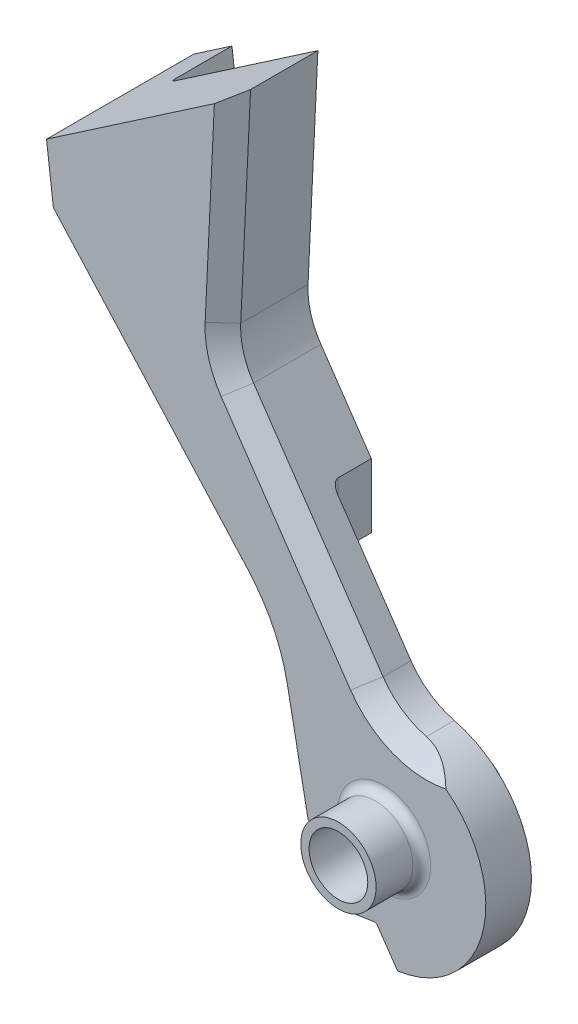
SolidWorks part; units mm, degrees
ref_plane "Front Plane" through (0, 0, 0) normal (0, 0, 1) x (1, 0, 0)
ref_plane "Top Plane" through (0, 0, 0) normal (0, 1, 0) x (1, 0, 0)
ref_plane "Right Plane" through (0, 0, 0) normal (1, 0, 0) x (0, 0, -1)
sketch "Sketch2" plane through (0, 0, 0) normal (0, 0, 1) x (1, 0, 0)
  line L0 (15.3614, 2.1858) -> (15.3614, 45.3658) construction
  line L1 (0, -25.763) -> (0, 67.1755) construction
  line L2 (-26.3835, 0) -> (21.8932, 0) construction
  line L3 (-28.3232, 32.6751) -> (-28.9114, 37.4651)
  line L4 (-28.9114, 37.4651) -> (-12.9596, 48.3622)
  line L5 (-12.9596, 48.3622) -> (-13.8036, 30.5968)
  line L6 (-12.7041, 26.7136) -> (-1.6127, 10.4774)
  line L7 (-28.3232, 32.6751) -> (-11.6865, 14.1982)
  line L8 (0, 0) -> (-8.5608, 69.7221) construction
  line L9 (0, 0) -> (2.9874, 62.8821) construction
  line L10 (0, -0.5588) -> (6.41, -9.8298) construction
  line L11 (-0.6, -6.6584) -> (1.1533, -9.1943)
  line L12 (-70.2091, -72.0281) -> (-53.2748, -69.9489)
  line L13 (-3.2592, -2.8122) -> (3.1507, -12.0832) construction
  line L14 (-0.8471, -6.5518) -> (-3.0719, -6.89)
  line L15 (-4.119, -6.32) -> (-3.2951, -4.3406)
  line L16 (-3.3817, -4.0364) -> (-6.5074, -1.7987)
  line L17 (-8.2943, 7.3945) -> (-6.5074, -1.7987)
  arc A0 (-13.8036, 30.5968) -> (-12.7041, 26.7136) centre (-7.4607, 30.2955) ccw
  arc A1 (1.1533, -9.1943) -> (2.1, 7.8965) centre (0, -0.5588) ccw
  arc A2 (2.1, 7.8965) -> (-1.6127, 10.4774) centre (3.6307, 14.0593) cw
  arc A3 (-4.119, -6.32) -> (-3.0719, -6.89) centre (0, 0) ccw
  arc A4 (-11.6865, 14.1982) -> (-8.2943, 7.3945) centre (-22.257, 4.6804) cw
  arc A5 (-0.8471, -6.5518) -> (-0.6, -6.6584) centre (-0.8089, -6.8029) cw
  arc A6 (-3.3817, -4.0364) -> (-3.2951, -4.3406) centre (-3.5296, -4.243) cw
  dimension "D5" = 6.35
  dimension "D9" = 8.7122
  dimension "D13" = 6.35
  dimension "D14" = 7.5438
  dimension "D19" = 14.224
  dimension "D26" = 0.254
  dimension "D1" = 43.18
  dimension "D2" = 7
  dimension "D3" = 2.72
  dimension "D4" = 15.24
  dimension "D6" = 47.244
  dimension "D7" = 48
  dimension "D8" = 24.13
  dimension "D10" = 0.5588
  dimension "D11" = 34.66
  dimension "D12" = 3.9624
  dimension "D15" = 22.6
  dimension "D16" = 103
  dimension "D17" = 2.286
  dimension "D18" = 11
  dimension "D20" = 4.826
  dimension "D21" = 0.8157
  dimension "D22" = 6.731
  dimension "D23" = 5.2506
  dimension "D24" = 6.35
  dimension "D25" = 116.015
extrude "Boss-Extrude1" add sketch "Sketch2" along normal blind 7.2898 contours L16 A6 L15 A3 L14 A5 L11 A1 A2 L6 A0 L5 L4 L3 L7 A4 L17
sketch "Sketch3" plane through (0, 0, 0) normal (0, 0, 1) x (1, 0, 0)
  circle A0 centre (0, 0) radius 3.3528
  circle A1 centre (0, 0) radius 2.5146
  dimension "D1" = 5.0292
  dimension "D2" = 6.7056
extrude "Cut-Extrude2" cut sketch "Sketch3" against normal through all and the other way through all contours A1
sketch "Sketch4" plane through (3.7805, 2.5826, 0) normal (0.8257, 0.5641, 0) x (0, 0, -1)
  line L0 (-7.2898, -9.1736) -> (0, -9.1736) construction
  line L1 (-3.3782, -9.1736) -> (5.633, -9.1736)
  line L2 (-3.3782, -9.1736) -> (-3.3782, 17.018)
  line L3 (-3.3782, 17.018) -> (5.633, 17.018)
  line L4 (5.633, -9.1736) -> (5.633, 17.018)
  line L5 (-7.2898, 9.5611) -> (-7.2898, 5.3358) construction
  point P9 (-7.2898, 7.4484)
  dimension "D1" = 17.018
  dimension "D2" = 3.9116
extrude "Cut-Extrude3" cut sketch "Sketch4" against normal through all both and the other way through all
sketch "Sketch5" plane through (0, 0, 7.2898) normal (0, 0, 1) x (1, 0, 0)
  circle A0 centre (0, 0) radius 2.5146 construction
  circle A1 centre (0, 0) radius 2.5146
  circle A2 centre (0, 0) radius 3.2258
  dimension "D1" = 6.4516
extrude "Boss-Extrude2" add sketch "Sketch5" along normal blind 3.9116
sketch "Sketch6" plane through (0, 0, 11.2014) normal (0, 0, 1) x (1, 0, 0)
  circle A0 centre (0, 0) radius 3.2258 construction
  circle A1 centre (0, 0) radius 2.5146 construction
  circle A2 centre (0, 0) radius 3.2258
  circle A3 centre (0, 0) radius 2.5146
extrude "Boss-Extrude3" add sketch "Sketch6" against normal blind 11.43
fillet "Fillet1" radius 0.762 2 edges at (3.2258, 0, 3.3782) (3.2258, 0, 7.2898)
chamfer "Chamfer1" distance 1.524 angle 45 2 edges at (-13.5705, 28.5656, 7.2898) (-13.3816, 39.4795, 7.2898)
chamfer "Chamfer2" distance 1.524 angle 45 2 edges at (0.0062, 8.8453, 7.2898) (-5.8452, 16.6733, 7.2898)
sketch "Sketch7" plane through (0, 0, 0) normal (0, 0, -1) x (-1, 0, 0)
  line L0 (28.3232, 32.6751) -> (11.6865, 14.1982) construction
  line L1 (28.3232, 32.6751) -> (28.9114, 37.4651) construction
  line L2 (28.9114, 37.4651) -> (12.9596, 48.3622) construction
  line L3 (28.3232, 32.6751) -> (24.2341, 28.1336)
  line L4 (28.3232, 32.6751) -> (28.9114, 37.4651)
  line L5 (28.9114, 37.4651) -> (25.6531, 39.6909)
  line L6 (0, 0) -> (0, 48.3622) construction
  line L7 (0, 0) -> (5.9104, 48.1363) construction
  line L8 (24.2341, 28.1336) -> (25.6531, 39.6909)
  line L9 (20.4711, -2.5135) -> (26.3815, 45.6228) construction
  dimension "D1" = 20.6248
extrude "Boss-Extrude4" add sketch "Sketch7" along normal blind 5.334
sketch "Sketch8" plane through (0, 0, 0) normal (0, 0, -1) x (-1, 0, 0)
  line L2 (8.382, 24.13) -> (1.27, 24.13)
  line L3 (1.27, 24.13) -> (1.27, 7.62)
  line L4 (1.27, 7.62) -> (8.382, 7.62)
  line L5 (8.382, 24.13) -> (8.382, 7.62)
  dimension "D1" = 1.27
  dimension "D2" = 7.62
  dimension "D3" = 16.51
  dimension "D4" = 7.112
extrude "Cut-Extrude4" cut sketch "Sketch8" against normal up to surface (3.3782 mm away)
fillet "Fillet2" radius 0.508 3 edges at (-24.9436, 33.9123, 0) (-9.621, 14.0374, 3.3782) (-8.382, 17.6353, 3.3782)
